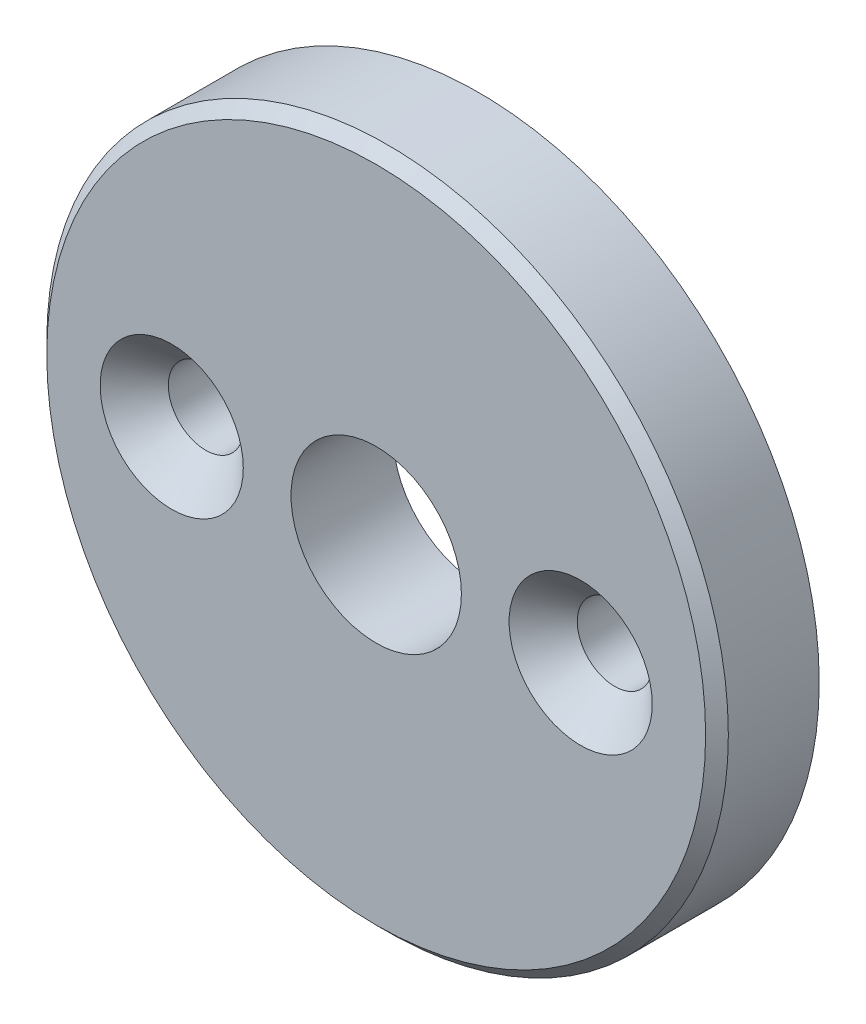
SolidWorks part; units mm, degrees
ref_plane "Plan de face" through (0, 0, 0) normal (0, 0, 1) x (1, 0, 0)
ref_plane "Plan de dessus" through (0, 0, 0) normal (0, 1, 0) x (1, 0, 0)
ref_plane "Plan de droite" through (0, 0, 0) normal (1, 0, 0) x (0, 0, -1)
sketch "Esquisse1" plane through (0, 0, 0) normal (0, 0, 1) x (1, 0, 0)
  circle A0 centre (0, 0) radius 7.5
  circle A1 centre (0, 0) radius 30
extrude "Extrusion1" add sketch "Esquisse1" along normal blind 9
chamfer "Chanfrein1" distance 1 angle 45 1 edges at (30, 0, 9)
hole_wizard "Fraisage pour vis à tête fraisée M61" positions "Esquisse3" profile "Esquisse2" countersink size "M6" standard "Ansi Métrique"
sketch "Esquisse3" plane through (0, 0, 9) normal (0, 0, 1) x (1, 0, 0)
  circle A0 centre (0, 0) radius 7.5 construction
  point P0 (-18, 0)
  dimension "D1" = 18
sketch "Esquisse2" plane through (-18, 0, 9) normal (1, 0, 0) x (0, -1, 0)
  line L0 (0, 0) -> (0, 9)
  line L1 (0, 9) -> (3.3, 9)
  line L2 (3.3, 9) -> (3.3, 3)
  line L3 (3.3, 3) -> (6.3, 0)
  line L5 (6.3, 0) -> (0, 0)
  line L6 (-3.3, 3) -> (-6.3, 0) construction
  line L11 (0, -6.35) -> (0, 107.95) construction
  dimension "Diamètre du perçage jusqu'au prochain" = 6.6
  dimension "Profondeur du perçage jusqu'au prochain" = 9
  dimension "Diamètre du fraisage entrant" = 12.6
  dimension "Angle du fraisage entrant" = 90
mirror "Symétrie1" about plane through (0, 0, 0) normal (1, 0, 0) of "Fraisage pour vis à tête fraisée M61"
